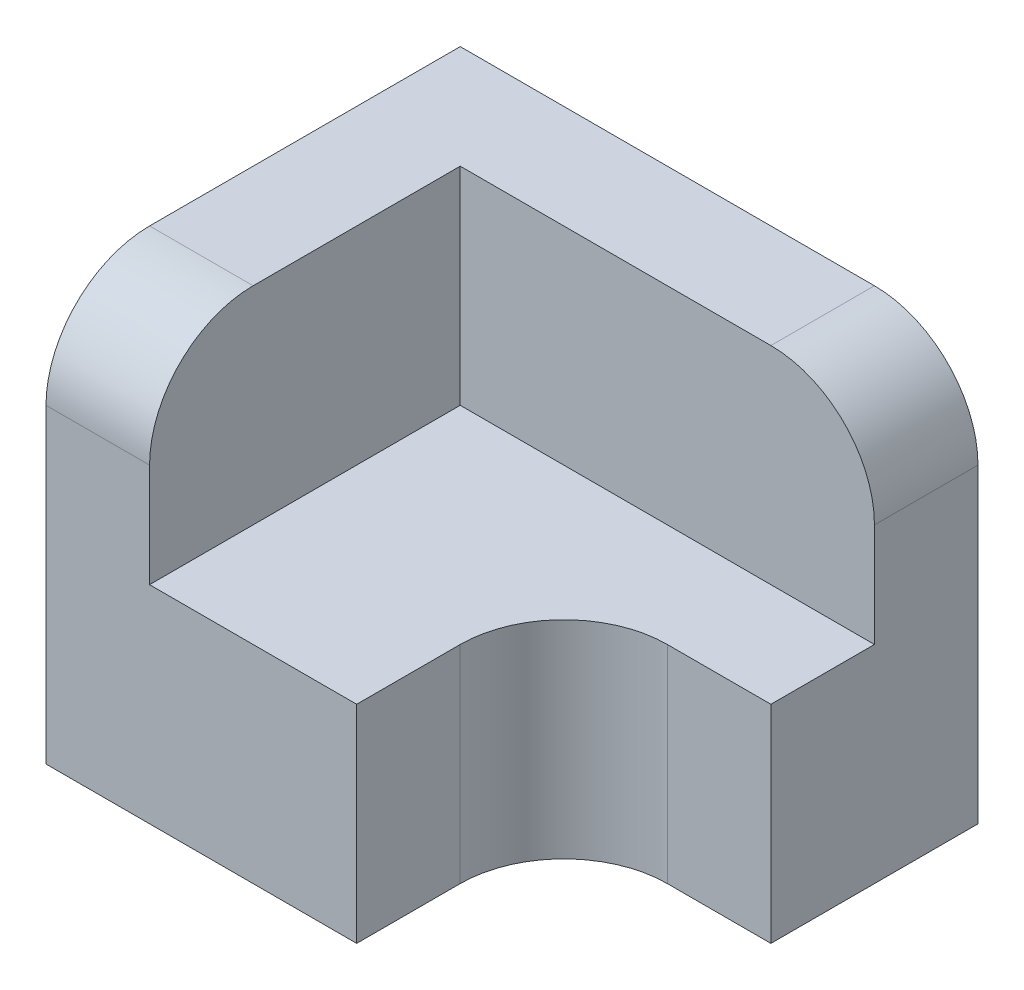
SolidWorks part; units mm, degrees
ref_plane "Front Plane" through (0, 0, 0) normal (0, 0, 1) x (1, 0, 0)
ref_plane "Top Plane" through (0, 0, 0) normal (0, 1, 0) x (1, 0, 0)
ref_plane "Right Plane" through (0, 0, 0) normal (1, 0, 0) x (0, 0, -1)
sketch "Sketch1" plane through (0, 0, 0) normal (0, 1, 0) x (1, 0, 0)
  line L0 (50, 20) -> (30, 20)
  line L1 (0, 0) -> (30, 0)
  line L2 (0, 0) -> (0, 40)
  line L3 (0, 40) -> (50, 40)
  line L4 (50, 20) -> (50, 40)
  line L5 (30, 20) -> (30, 0)
  dimension "D1" = 20
  dimension "D2" = 50
  dimension "D3" = 20
  dimension "D4" = 40
extrude "Extrude1" add sketch "Sketch1" along normal blind 20
sketch "Sketch2" plane through (0, 20, 0) normal (0, 1, 0) x (1, 0, 0)
  line L0 (50, 40) -> (0, 40) construction
  line L1 (0, 40) -> (0, 0) construction
  line L2 (50, 40) -> (0, 40)
  line L3 (0, 40) -> (0, 0)
extrude "Extrude-Thin1" add sketch "Sketch2" along normal blind 20 thin
fillet "Fillet1" radius 10 3 edges at (30, 10, -20) (50, 40, -35) (5, 40, 0)
